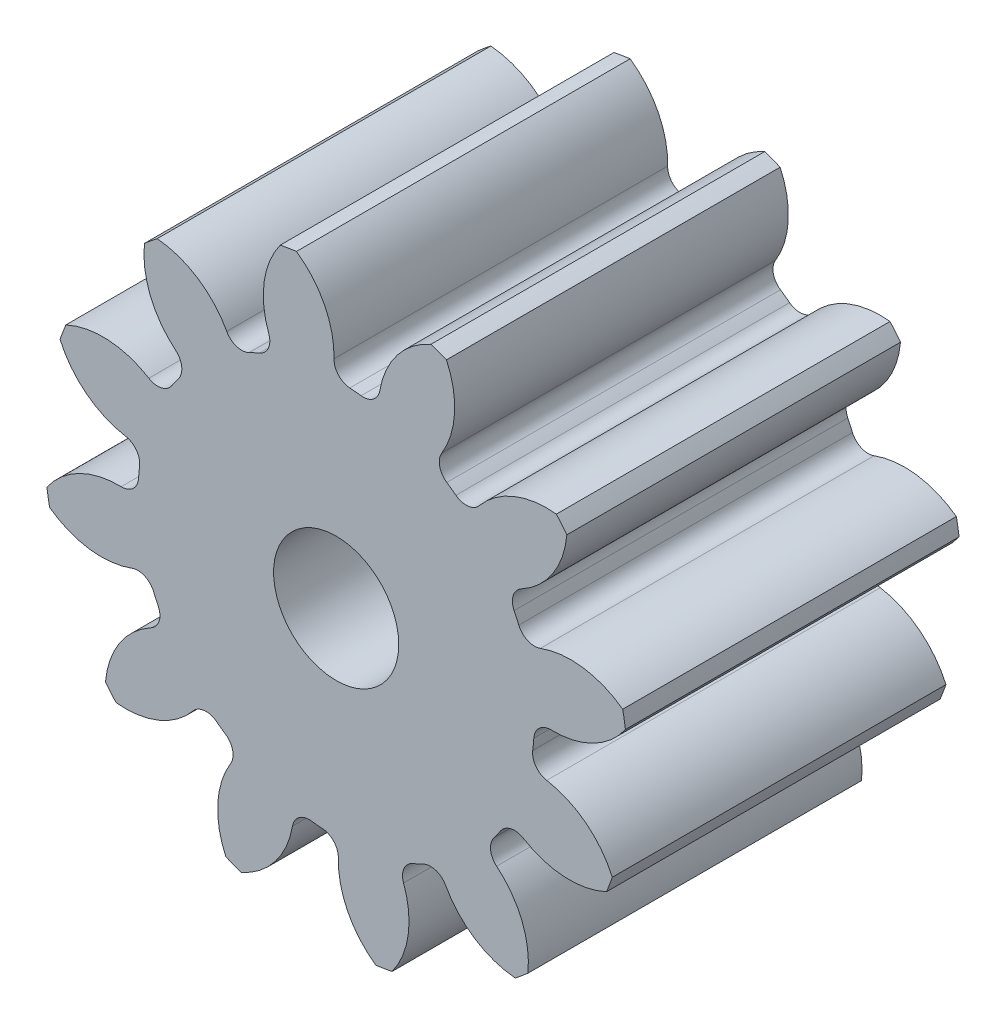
SolidWorks part; units mm, degrees
ref_plane "Front" through (0, 0, 0) normal (0, 0, 1) x (1, 0, 0)
ref_plane "Top" through (0, 0, 0) normal (0, 1, 0) x (1, 0, 0)
ref_plane "Right" through (0, 0, 0) normal (1, 0, 0) x (0, 0, -1)
sketch "Sketch3" plane through (0, 0, 0) normal (0, 0, 1) x (1, 0, 0)
  circle A0 centre (0, 0) radius 88.9
  dimension "od" = 177.8
extrude "gearBody" add sketch "Sketch3" along normal blind 101.6
sketch "Sketch2" plane through (0, 0, 0) normal (0, 0, 1) x (1, 0, 0)
  line L0 (0, 0) -> (66.154, 27.4019) construction
  line L1 (84.6446, -30.2682) -> (0, 0) construction
  line L2 (0, 0) -> (36.3143, 0) construction
  line L3 (76.1558, 2.595) -> (74.2167, -17.2722) construction
  line L5 (75.1862, -7.3386) -> (0, 0) construction
  line L7 (0, 0) -> (71.6046, 0) construction
  arc A0 (71.5943, 1.2137) -> (70.0083, -15.0349) centre (0, 0) ccw construction
  arc A1 (88.0758, 12.077) -> (84.0782, -28.8803) centre (0, 0) ccw construction
  arc A2 (76.1558, 2.595) -> (74.2167, -17.2722) centre (0, 0) ccw construction
  arc A3 (59.8485, -7.5672) -> (60.1822, -4.1485) centre (0, 0) ccw
  arc A4 (84.6446, -30.2682) -> (64.1069, -13.3108) centre (59.6067, -39.6769) ccw
  arc A5 (84.6446, -30.2682) -> (88.9, 13.3293) centre (0, 0) ccw
  arc A6 (88.9, 13.3293) -> (65.4709, 0.6633) centre (66.154, 27.4019) cw
  arc A7 (60.1822, -4.1485) -> (65.4709, 0.6633) centre (65.3389, -4.5039) cw
  arc A8 (64.1069, -13.3108) -> (59.8485, -7.5672) centre (64.9766, -8.2156) cw
  point P6 (88.9, 13.3293)
  point P22 (84.6446, -30.2682)
  dimension "baseDia" = 143.2092
  dimension "od" = 177.8
  dimension "pd" = 152.4
  dimension "rd" = 120.65
  dimension "rFillet" = 5.1689
  dimension "pointX" = 88.9
  dimension "pointY" = 13.3293
  dimension "CTT" = 19.8672
  dimension "flankCenterAngle" = 22.5
extrude "toothCut" cut sketch "Sketch2" along normal through all
pattern_circular "CirPattern1" count 12 over 360 about axis through (0, 0, 0) along (0, 0, 1) of "toothCut"
sketch "hub1Dia" plane through (0, 0, 0) normal (0, 0, -1) x (-1, 0, 0)
  circle A0 centre (0, 0) radius 12.7
  dimension "hub1Dia" = 25.4
sketch "hub2Dia" plane through (0, 0, 101.6) normal (0, 0, 1) x (1, 0, 0)
  circle A0 centre (0, 0) radius 12.7
  dimension "hub2dia" = 25.4
sketch "boreDia" plane through (0, 0, 0) normal (0, 0, 1) x (1, 0, 0)
  circle A0 centre (0, 0) radius 19.05
  dimension "boreDia" = 38.1
extrude "bore" cut sketch "boreDia" against normal mid plane 25400
